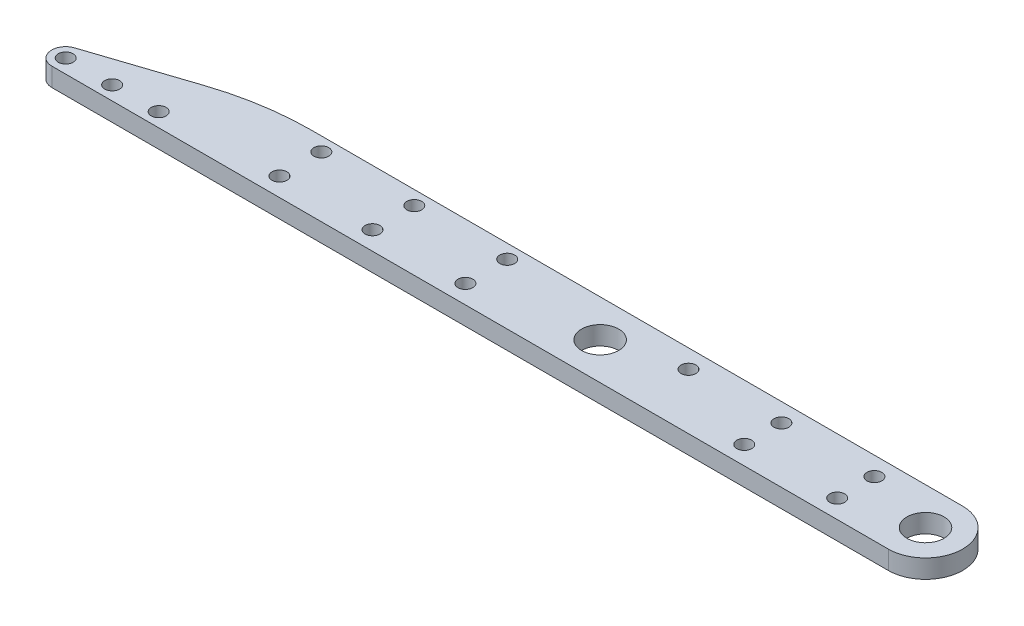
SolidWorks part; units mm, degrees
ref_plane "前视基准面" through (0, 0, 0) normal (0, 0, 1) x (1, 0, 0)
ref_plane "上视基准面" through (0, 0, 0) normal (0, 1, 0) x (1, 0, 0)
ref_plane "右视基准面" through (0, 0, 0) normal (1, 0, 0) x (0, 0, -1)
other "Configuration Table"
sketch "草图1" plane through (0, 0, 0) normal (0, 1, 0) x (1, 0, 0)
  line L0 (0, -8) -> (-180, -8)
  line L1 (-180.9424, -2.1518) -> (-160, 4.7773)
  line L2 (-140, 8) -> (0, 8)
  line L3 (-180, -5) -> (-170, -5) construction
  arc A0 (0, 8) -> (0, -8) centre (0, 0) cw
  arc A1 (-180, -8) -> (-180.9424, -2.1518) centre (-180, -5) cw
  circle A2 centre (0, 0) radius 4
  circle A3 centre (-70, 0) radius 4
  circle A4 centre (-180, -5) radius 1.6
  circle A5 centre (-170, -5) radius 1.6
  circle A6 centre (-160, -5) radius 1.6
  arc A7 (-160, 4.7773) -> (-140, 8) centre (-140, -55.6703) cw
  dimension "D1" = 8
  dimension "D6" = 3.2
  dimension "D8" = 180
  dimension "D2" = 16
  dimension "D3" = 70
  dimension "D5" = 10
  dimension "D7" = 3
  dimension "D9" = 70
  dimension "D10" = 20
  dimension "D4" = 3
extrude "凸台-拉伸1" add sketch "草图1" along normal blind 4
sketch "草图2" plane through (0, 4, 0) normal (0, 1, 0) x (1, 0, 0)
  line L0 (-135, 5) -> (-115, 5) construction
  line L1 (0, 8) -> (-140, 8) construction
  line L2 (-180, -8) -> (0, -8) construction
  circle A0 centre (-135, 5) radius 1.6
  circle A1 centre (-115, 5) radius 1.6
  circle A2 centre (-95, 5) radius 1.6
  circle A3 centre (-160, -5) radius 1.6 construction
  circle A4 centre (-135, -4) radius 1.6
  circle A5 centre (-115, -4) radius 1.6
  circle A6 centre (-95, -4) radius 1.6
  circle A8 centre (-35, -4) radius 1.6
  circle A9 centre (-15, -4) radius 1.6
  circle A10 centre (-70, 0) radius 4 construction
  circle A11 centre (-55, 4) radius 1.6
  circle A12 centre (-35, 4) radius 1.6
  circle A13 centre (-15, 4) radius 1.6
  circle A14 centre (-55, -4) radius 1.6
  point P22 (0, 0)
  dimension "D3" = 3.2
  dimension "D8" = 35
  dimension "D13" = 3.2
  dimension "D1" = 20
  dimension "D4" = 25
  dimension "D5" = 3
  dimension "D7" = 4
  dimension "D10" = 2
  dimension "D11" = 4
  dimension "D12" = 20
  dimension "D2" = 3
  dimension "D6" = 2
  dimension "D9" = 2
extrude "切除-拉伸1" cut sketch "草图2" against normal through all
